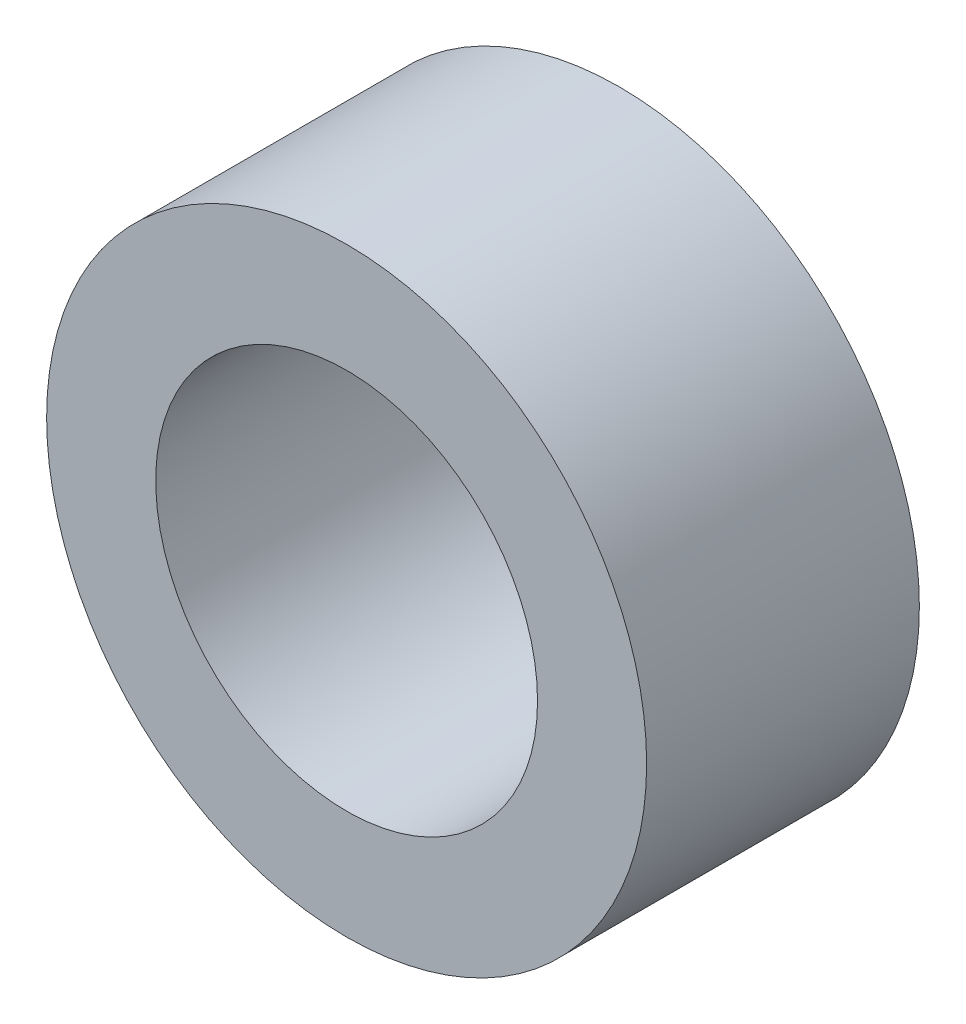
SolidWorks part; units mm, degrees
ref_plane "Спереди" through (0, 0, 0) normal (0, 0, 1) x (1, 0, 0)
ref_plane "Сверху" through (0, 0, 0) normal (0, 1, 0) x (1, 0, 0)
ref_plane "Справа" through (0, 0, 0) normal (1, 0, 0) x (0, 0, -1)
sketch "Эскиз1" plane through (0, 0, 0) normal (0, 0, 1) x (1, 0, 0)
  circle A0 centre (0, 0) radius 2.75
  circle A1 centre (0, 0) radius 1.75
  dimension "D1" = 3.5
  dimension "D2" = 5.5
extrude "Бобышка-Вытянуть1" add sketch "Эскиз1" along normal blind 2.5
